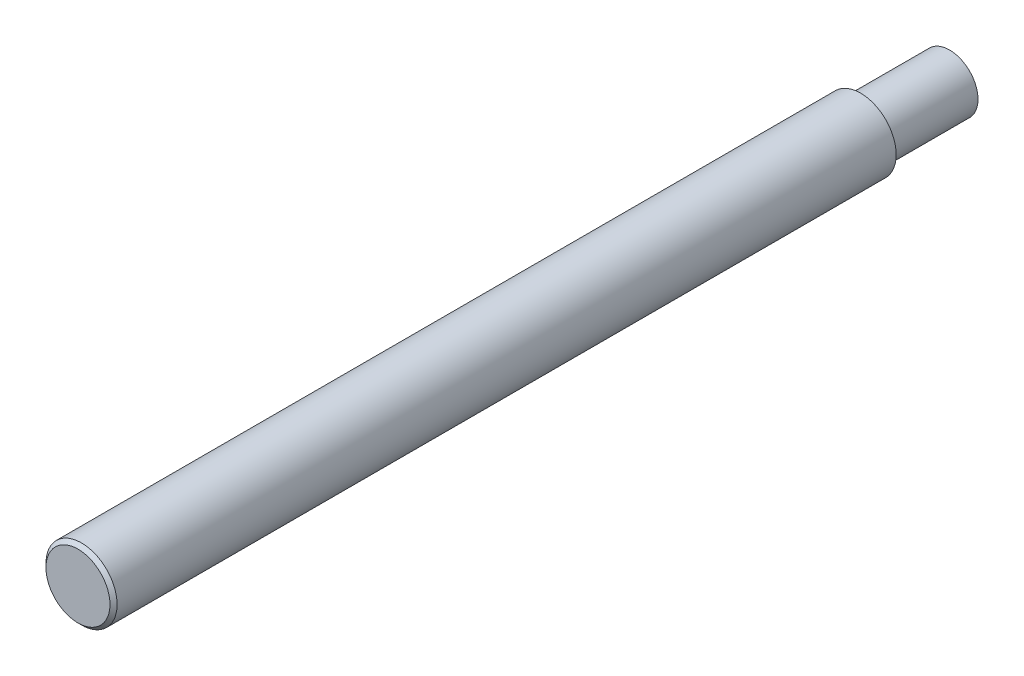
SolidWorks part; units mm, degrees
ref_plane "前视基准面" through (0, 0, 0) normal (0, 0, 1) x (1, 0, 0)
ref_plane "上视基准面" through (0, 0, 0) normal (0, 1, 0) x (1, 0, 0)
ref_plane "右视基准面" through (0, 0, 0) normal (1, 0, 0) x (0, 0, -1)
sketch "草图1" plane through (0, 0, 0) normal (0, 0, 1) x (1, 0, 0)
  circle A0 centre (0, 0) radius 10
extrude "凸台-拉伸1" add sketch "草图1" along normal blind 220
sketch "草图2" plane through (0, 0, 0) normal (0, 0, -1) x (-1, 0, 0)
  circle A0 centre (0, 0) radius 8
extrude "凸台-拉伸2" add sketch "草图2" along normal blind 25
chamfer "倒角1" distance 1 angle 45 1 edges at (10, 0, 220)
